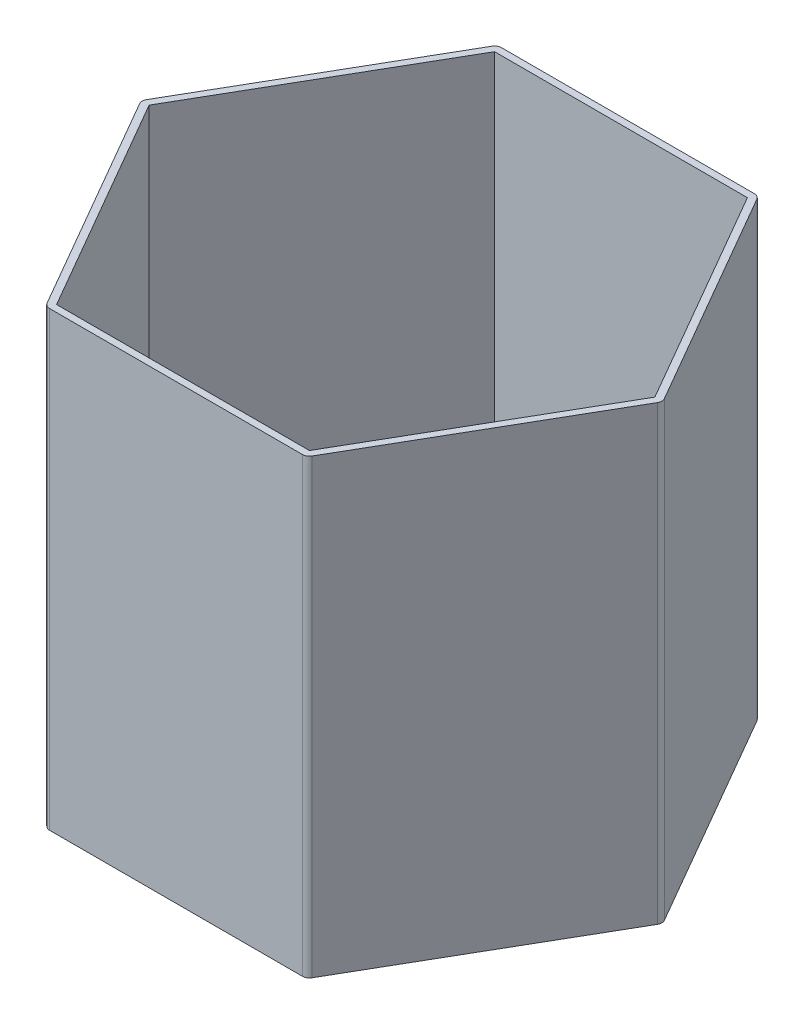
SolidWorks part; units mm, degrees
ref_plane "Front Plane" through (0, 0, 0) normal (0, 0, 1) x (1, 0, 0)
ref_plane "Top Plane" through (0, 0, 0) normal (0, 1, 0) x (1, 0, 0)
ref_plane "Right Plane" through (0, 0, 0) normal (1, 0, 0) x (0, 0, -1)
sketch "Sketch1" plane through (0, 0, 0) normal (0, 1, 0) x (1, 0, 0)
  line L1 (92.3876, 165.1) -> (-92.3876, 165.1)
  line L2 (-96.787, 162.56) -> (-189.1746, 2.54)
  line L3 (-189.1746, -2.54) -> (-96.787, -162.56)
  line L4 (-92.3876, -165.1) -> (92.3876, -165.1)
  line L5 (96.787, -162.56) -> (189.1746, -2.54)
  line L6 (189.1746, 2.54) -> (96.787, 162.56)
  circle A0 centre (0, 0) radius 165.1 construction
  arc A1 (-92.3876, 165.1) -> (-96.787, 162.56) centre (-92.3876, 160.02) ccw
  arc A2 (-189.1746, 2.54) -> (-189.1746, -2.54) centre (-184.7752, 0) ccw
  arc A3 (-96.787, -162.56) -> (-92.3876, -165.1) centre (-92.3876, -160.02) ccw
  arc A4 (92.3876, -165.1) -> (96.787, -162.56) centre (92.3876, -160.02) ccw
  arc A5 (189.1746, -2.54) -> (189.1746, 2.54) centre (184.7752, 0) ccw
  arc A6 (92.3876, 165.1) -> (96.787, 162.56) centre (92.3876, 160.02) cw
  dimension "D2" = 5.08
  dimension "D1" = 330.2
extrude "Extrude1" add sketch "Sketch1" along normal blind 330.2
shell "Shell1" thickness 5.08
